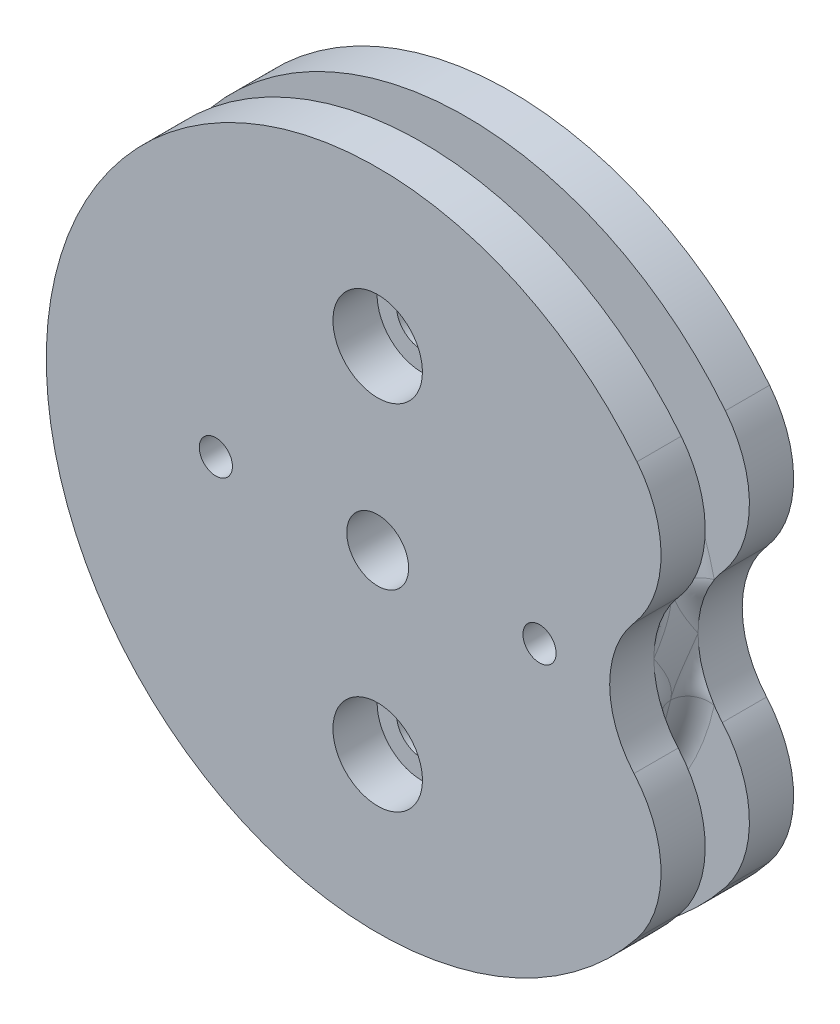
SolidWorks part; units mm, degrees
ref_plane "Front Plane" through (0, 0, 0) normal (0, 0, 1) x (1, 0, 0)
ref_plane "Top Plane" through (0, 0, 0) normal (0, 1, 0) x (1, 0, 0)
ref_plane "Right Plane" through (0, 0, 0) normal (1, 0, 0) x (0, 0, -1)
sketch "values-params_print" plane through (0, 0, 0) normal (0, 0, 1) x (1, 0, 0)
  line L0 (0, 0) -> (0.7, 0) construction
  line L1 (0, -5.2349) -> (3, -5.2349) construction
  line L2 (0, -10.104) -> (4, -10.104) construction
  line L3 (0, -15.1093) -> (100, -15.1093) construction
  line L4 (0, -19.837) -> (0.15, -19.837) construction
  line L5 (0, -24.2596) -> (0.3, -24.2596) construction
  line L6 (0, -28.606) -> (3.175, -28.606) construction
  line L7 (0, -33.0286) -> (9.5, -33.0286) construction
  line L8 (0, -37.6038) -> (2.4, -37.6038) construction
  line L9 (0, -43.1661) -> (6.35, -43.1661) construction
  dimension "width destroy" = 0.7
  dimension "width keep" = 3
  dimension "width tab" = 4
  dimension "base diameter" = 100
  dimension "print fit" = 0.15
  dimension "print free" = 0.3
  dimension "pin diameter" = 3.175
  dimension "pulley diameter" = 9.5
  dimension "pulley thickness" = 2.4
  dimension "base pin diameter" = 6.35
inserted part "params_print"
sketch "Sketch1" plane through (0, 0, 0) normal (0, 0, 1) x (1, 0, 0)
  line L0 (0, 15) -> (0, -15) construction
  line L1 (0, 0) -> (-15, 0) construction
  circle A0 centre (0, 0) radius 15
  circle A1 centre (0, 0) radius 4.15
  circle A2 centre (0, 8) radius 2.025
  circle A3 centre (0, -8) radius 2.025
  point P24 (0, 0)
  dimension "D1" = 30
  dimension "D2" = 8.3
  dimension "D3" = 4.05
  dimension "D4" = 8
extrude "Main Body" add sketch "Sketch1" along normal mid plane 6
sketch "Sketch2" plane through (0, 0, 3) normal (0, 0, 1) x (1, 0, 0)
  circle A0 centre (0, 0) radius 4.15 construction
  circle A1 centre (0, 0) radius 4.15
  circle A2 centre (0, 0) radius 1.4
  dimension "D1" = 2.8
extrude "Main Bolt Surface" add sketch "Sketch2" against normal offset from surface (3.15 mm away) 2.85
sketch "Sketch4" plane through (0, 0, 0) normal (0, 0, 1) x (1, 0, 0)
  circle A0 centre (0, 0) radius 15 construction
  circle A1 centre (0, 0) radius 15
  circle A2 centre (0, 0) radius 10.5
  circle A3 centre (0, 8) radius 2.025 construction
  circle A4 centre (0, 8) radius 2.025 construction
  dimension "D1" = 21
extrude "Pulley Slot" cut sketch "Sketch4" against normal mid plane 2
sketch "Sketch5" plane through (0, 0, -3) normal (0, 0, -1) x (-1, 0, 0)
  line L0 (0, 0) -> (15, 0) construction
  circle A1 centre (0, 8) radius 2.025 construction
  circle A8 centre (0, 0) radius 15 construction
  circle A9 centre (0, 8) radius 2.025
  circle A10 centre (0, -8) radius 1.15
  circle A11 centre (0, -8) radius 2.025
  circle A16 centre (0, 8) radius 1.15
  dimension "D1" = 2.3
extrude "Support Bolt Surface" add sketch "Sketch5" against normal offset from surface (4 mm away) 2
sketch "Sketch6" plane through (0, 0, 3) normal (0, 0, 1) x (1, 0, 0)
  line L0 (0, 15) -> (0, -15) construction
  line L1 (0, 0) -> (15, 0) construction
  circle A0 centre (0, 0) radius 15 construction
  circle A1 centre (15, 0) radius 4.5
  circle A3 centre (0, 0) radius 10.5 construction
extrude "Tendon Anchor Clearance" cut sketch "Sketch6" against normal through all
fillet "Inner Contouring" radius 1 2 edges at (10.5, 0, -1) (10.5, 0, 1)
sketch "Sketch8" plane through (0, 0, -3) normal (0, 0, -1) x (-1, 0, 0)
  line L0 (-4.15, 0) -> (-10.5, 0) construction
  line L1 (0, 0) -> (0, 15) construction
  circle A2 centre (0, 0) radius 4.15 construction
  arc A3 (-14.325, -4.4491) -> (-14.325, 4.4491) centre (-15, 0) ccw construction
  circle A4 centre (-7.325, 0) radius 0.75
  circle A5 centre (7.325, 0) radius 0.75
  dimension "D1" = 1.5
extrude "Tendon Anchor" cut sketch "Sketch8" against normal through all
fillet "Contouring" radius 5 4 edges at (14.325, -4.4491, 2) (14.325, 4.4491, 2) (14.325, -4.4491, -2) (14.325, 4.4491, -2)
ref_point "Ref Center"
equation "\"D2@Sketch1\" = 8 + \"print free@values@params_print.sldprt\""
equation "\"D3@Sketch1\" = 3.75 + \"print free@values@params_print.sldprt\""
equation "\"D1@Sketch5\" = 2 + \"print free@values@params_print.sldprt\""
equation "\"D1@Sketch2\" = 2.5 + \"print free@values@params_print.sldprt\""
equation "\"D1@Sketch8\" = \"width keep@values@params_print.sldprt\" / 2"
